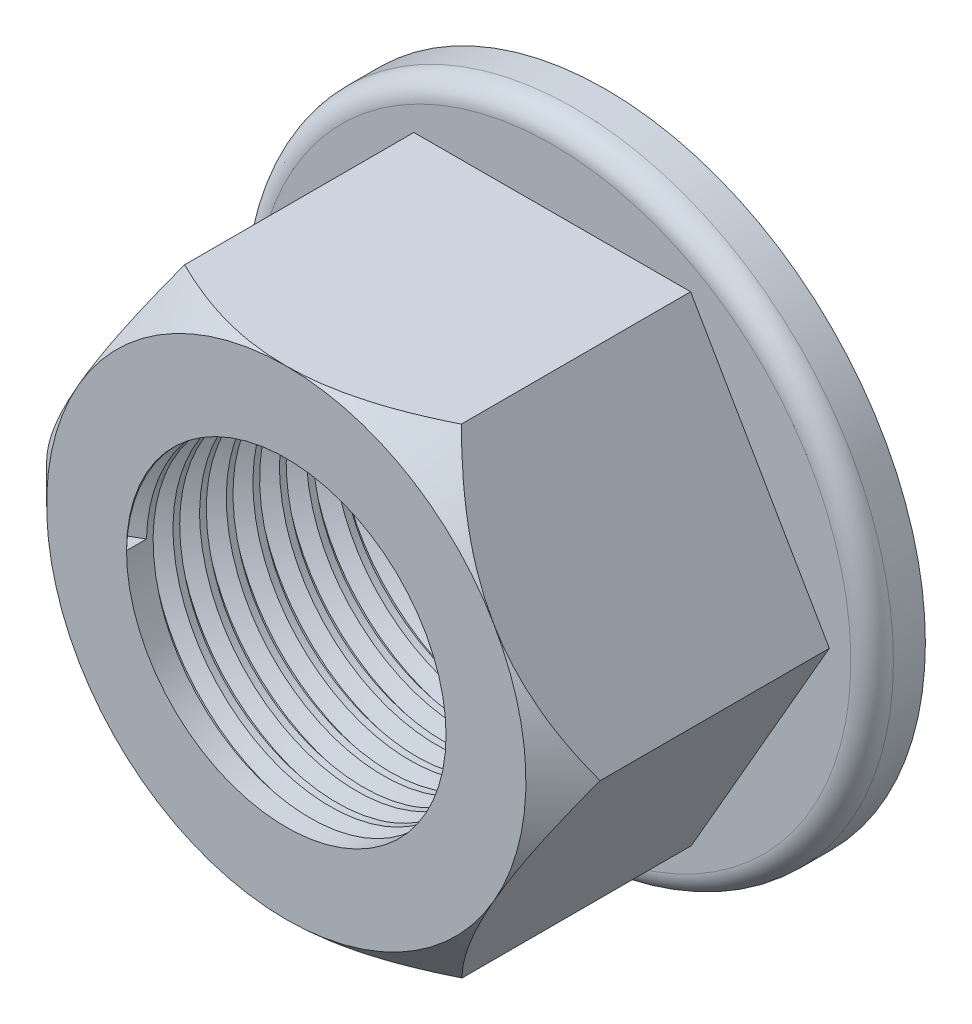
SolidWorks part; units mm, degrees
ref_plane "Front Plane" through (0, 0, 0) normal (0, 0, 1) x (1, 0, 0)
ref_plane "Top Plane" through (0, 0, 0) normal (0, 1, 0) x (1, 0, 0)
ref_plane "Right Plane" through (0, 0, 0) normal (1, 0, 0) x (0, 0, -1)
sketch "Sketch1" plane through (0, 0, 0) normal (0, 0, 1) x (1, 0, 0)
  line L1 (8.2273, 14.2999) -> (-8.2704, 14.2751)
  line L2 (-8.2704, 14.2751) -> (-16.4978, -0.0249)
  line L3 (-16.4978, -0.0249) -> (-8.2273, -14.2999)
  line L4 (-8.2273, -14.2999) -> (8.2704, -14.2751)
  line L5 (8.2704, -14.2751) -> (16.4978, 0.0249)
  line L6 (16.4978, 0.0249) -> (8.2273, 14.2999)
  circle A0 centre (0, 0) radius 9.525
  circle A1 centre (0, 0) radius 14.2875 construction
  point P3 (-12.3626, -7.1624)
  dimension "D1" = 19.05
  dimension "D2" = 28.575
extrude "Boss-Extrude1" add sketch "Sketch1" along normal blind 15.875
sketch "Sketch2" plane through (0, 0, 0) normal (0, 0, -1) x (-1, 0, 0)
  circle A0 centre (0, 0) radius 19.05
  circle A1 centre (0, 0) radius 9.525
  dimension "D1" = 38.1
extrude "Boss-Extrude2" add sketch "Sketch2" along normal blind 3.175
fillet "Fillet1" radius 1.27 1 edges at (-19.05, 0, 0)
sketch "Sketch3" plane through (0, 0, 15.875) normal (0, 0, 1) x (1, 0, 0)
  circle A0 centre (0, 0) radius 14.2875
extrude "Cut-Extrude3" cut sketch "Sketch3" against normal blind 3.175 draft 45 flip side to cut
thread "Thread1" pitch 1.5875 start angle 0, offset 0, length 22.7, pitch 1.5875, diameter 19.05
ref_plane "Plane2" through (-9.525, 0, 15.875) normal (0, -1, 0) x (-1, 0, 0)
sketch "Thread Profile1" plane through (-9.525, 0, 15.875) normal (0, -1, 0) x (-1, 0, 0)
  line L0 (0, 0) -> (0, 1.5875) construction
  line L1 (0, 0) -> (0.8593, 0.4961)
  line L2 (0.8593, 0.4961) -> (0.8593, 0.6945)
  line L3 (0.8593, 0.6945) -> (0, 1.1906)
  line L4 (0.8593, 0.5953) -> (0, 0.5953) construction
  line L11 (0, 0) -> (0, 1.1906)
  point P2 (0, 0)
  dimension "Pitch" = 1.5875
  dimension "Profile_Angle" = 60
  dimension "Profile_Land" = 0.1984
  dimension "Profile_Height" = 0.8593
